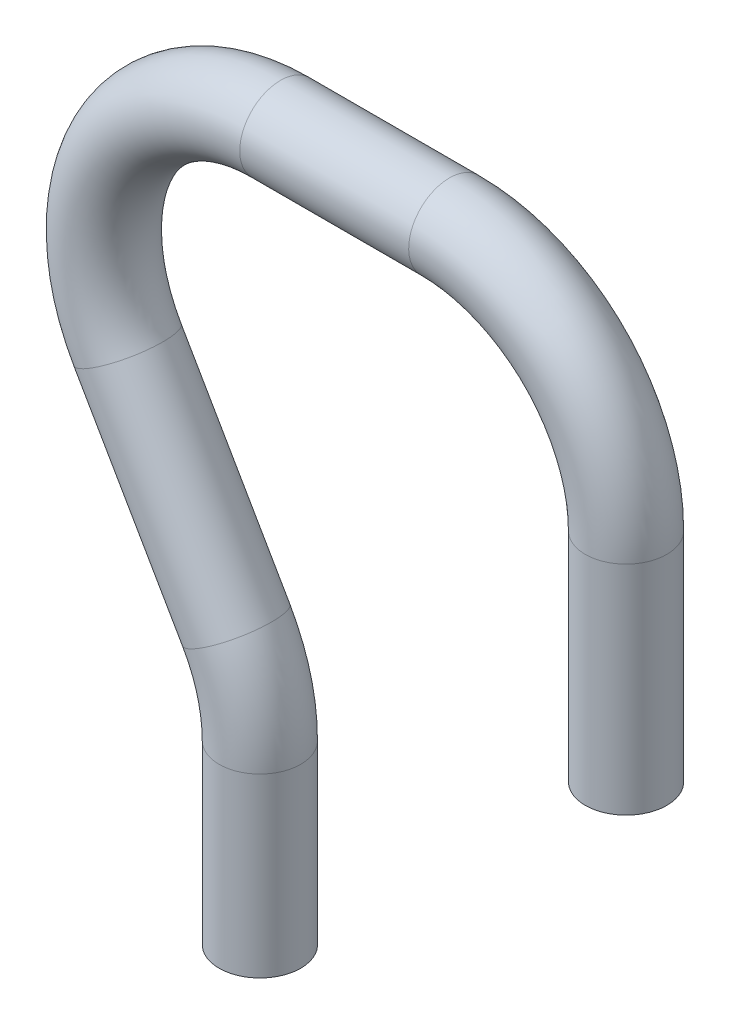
SolidWorks part; units mm, degrees
ref_plane "Front Plane" through (0, 0, 0) normal (0, 0, 1) x (1, 0, 0)
ref_plane "Top Plane" through (0, 0, 0) normal (0, 1, 0) x (1, 0, 0)
ref_plane "Right Plane" through (0, 0, 0) normal (1, 0, 0) x (0, 0, -1)
sketch "Sketch1" plane through (0, 0, 0) normal (0, 0, 1) x (1, 0, 0)
  line L0 (0, 0) -> (0, 20.6375)
  line L1 (2.4077, 83.9095) -> (22.1462, 83.9095)
  line L2 (42.7837, 63.272) -> (42.7837, 37.872)
  line L4 (42.7837, 40.1623) -> (42.7837, 45.5033) construction
  line L6 (-15.4649, 52.9533) -> (-2.7649, 30.9562)
  arc A0 (-2.7649, 30.9562) -> (0, 20.6375) centre (-20.6375, 20.6375) cw
  arc A1 (-15.4649, 52.9533) -> (2.4077, 83.9095) centre (2.4077, 63.272) cw
  arc A2 (22.1462, 83.9095) -> (42.7837, 63.272) centre (22.1462, 63.272) cw
  dimension "D1" = 20.6375
  dimension "D5" = 20.6375
  dimension "D6" = 20.6375
  dimension "D2" = 20.6375
  dimension "D3" = 25.4
  dimension "D4" = 150
  dimension "D7" = 25.4
sketch "Sketch2" plane through (0, 0, 0) normal (0, 1, 0) x (1, 0, 0)
  circle A0 centre (0, 0) radius 4.7625
  circle A1 centre (0, 0) radius 3.8735
  dimension "D1" = 0.889
  dimension "D2" = 9.525
sweep "Sweep1" add profiles "Sketch2" path "Sketch1"
